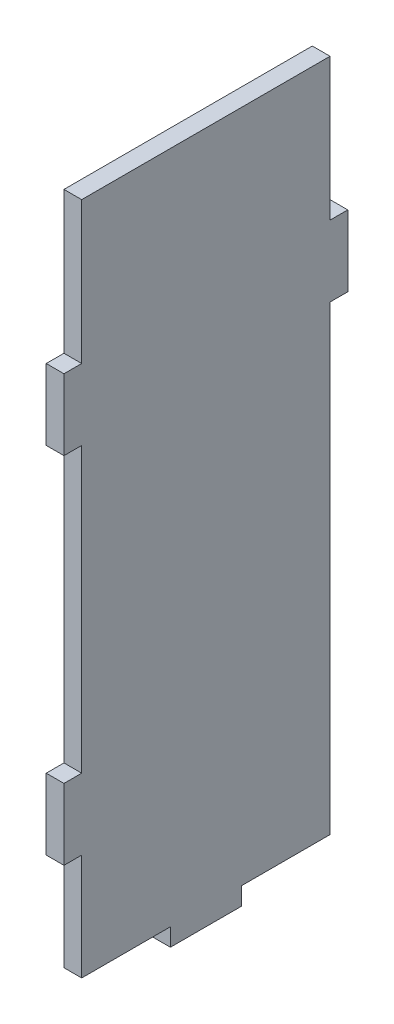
SolidWorks part; units mm, degrees
ref_plane "Front Plane" through (0, 0, 0) normal (0, 0, 1) x (1, 0, 0)
ref_plane "Top Plane" through (0, 0, 0) normal (0, 1, 0) x (1, 0, 0)
ref_plane "Right Plane" through (0, 0, 0) normal (1, 0, 0) x (0, 0, -1)
sketch "Sketch1" plane through (0, 0, 0) normal (1, 0, 0) x (0, 0, -1)
  line L1 (-22.225, -63.5) -> (22.225, -63.5)
  line L2 (-22.225, -63.5) -> (-22.225, 63.5)
  line L3 (-22.225, 63.5) -> (22.225, 63.5)
  line L4 (22.225, -63.5) -> (22.225, 63.5)
  line L5 (-22.225, -63.5) -> (22.225, 63.5) construction
  line L6 (-22.225, 63.5) -> (22.225, -63.5) construction
  point P0 (0, 0)
extrude "Boss-Extrude1" add sketch "Sketch1" along normal mid plane 3.175
sketch "Sketch2" plane through (1.5875, 0, 0) normal (1, 0, 0) x (0, 0, -1)
  line L0 (-22.225, 63.5) -> (-22.225, -63.5) construction
  line L1 (-22.225, 38.1) -> (-25.4, 38.1)
  line L2 (-22.225, 38.1) -> (-22.225, 25.4)
  line L3 (-22.225, 25.4) -> (-25.4, 25.4)
  line L4 (-25.4, 38.1) -> (-25.4, 25.4)
  line L5 (-25.4, 31.75) -> (-22.225, 31.75) construction
  line L6 (-22.225, -25.4) -> (-25.4, -25.4)
  line L7 (-22.225, -25.4) -> (-22.225, -38.1)
  line L8 (-22.225, -38.1) -> (-25.4, -38.1)
  line L9 (-25.4, -25.4) -> (-25.4, -38.1)
  line L10 (-25.4, -31.75) -> (-22.225, -31.75) construction
  line L11 (-1000, 0) -> (49000, 0) construction
extrude "Boss-Extrude2" add sketch "Sketch2" against normal up to surface (3.175 mm away)
mirror "Mirror1" about plane through (0, 0, 0) normal (0, 0, 1) of "Boss-Extrude2"
sketch "Sketch3" plane through (1.5875, 0, 0) normal (1, 0, 0) x (0, 0, -1)
  line L1 (-6.35, -60.325) -> (6.35, -60.325)
  line L2 (22.225, -57.15) -> (22.225, -63.5)
  line L3 (-22.225, -57.15) -> (-6.35, -57.15)
  line L4 (-6.35, -60.325) -> (-6.35, -57.15)
  line L5 (-22.225, -63.5) -> (22.225, -63.5) construction
  line L6 (22.225, -63.5) -> (-22.225, -63.5)
  line L7 (22.225, -57.15) -> (6.35, -57.15)
  line L8 (6.35, -60.325) -> (6.35, -57.15)
  line L9 (-22.225, -63.5) -> (-22.225, -57.15)
  line L10 (22.225, -63.5) -> (22.225, -38.1) construction
extrude "Cut-Extrude1" cut sketch "Sketch3" against normal through all
sketch "Sketch4" plane through (1.5875, 0, 0) normal (1, 0, 0) x (0, 0, -1)
  line L1 (25.4, -38.1) -> (22.225, -38.1)
  line L2 (25.4, -38.1) -> (25.4, -25.4)
  line L3 (25.4, -25.4) -> (22.225, -25.4)
  line L4 (22.225, -38.1) -> (22.225, -25.4)
extrude "Cut-Extrude2" cut sketch "Sketch4" against normal through all
equation "\"h\"= 5"
equation "\"plywoodThickness\"= .125"
equation "\"jointClearance\"= .000"
equation "\"D1@Sketch1\"=2-(2*\"plywoodThickness\")"
equation "\"D2@Sketch1\"=\"h\""
equation "\"D1@Boss-Extrude1\"=\"plywoodThickness\""
equation "\"D3@Sketch2\"=\"plywoodThickness\""
equation "\"D1@Sketch2\"=\"h\"/2"
equation "\"D2@Sketch3\"=\"plywoodThickness\""
equation "\"D3@Sketch3\"=\"plywoodThickness\"*2"
